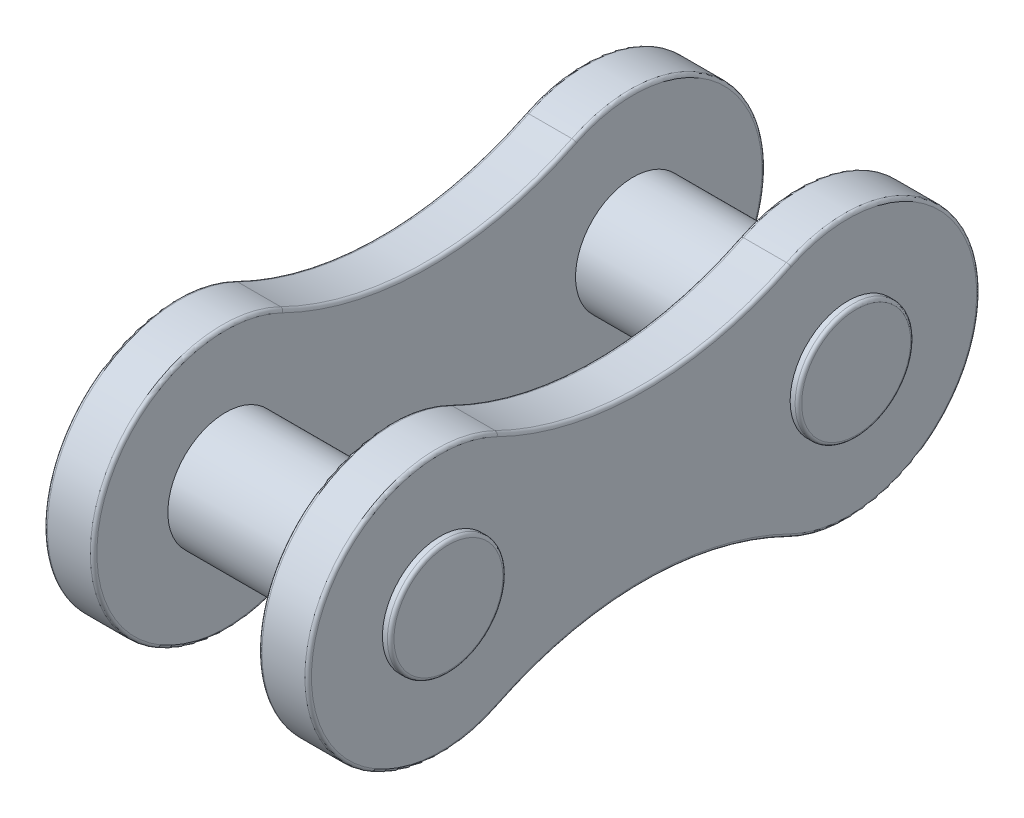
SolidWorks part; units mm, degrees
ref_plane "Front Plane" through (0, 0, 0) normal (0, 0, 1) x (1, 0, 0)
ref_plane "Top Plane" through (0, 0, 0) normal (0, 1, 0) x (1, 0, 0)
ref_plane "Right Plane" through (0, 0, 0) normal (1, 0, 0) x (0, 0, -1)
sketch "Sketch1" plane through (0, 0, 0) normal (1, 0, 0) x (0, 0, -1)
  line L0 (-6.175, 0) -> (6.175, 0) construction
  line L1 (0, 0) -> (0, 5.1759) construction
  circle A0 centre (-6.175, 0) radius 1.75
  arc A1 (-4.4107, 3.5899) -> (-4.4107, -3.5899) centre (-6.175, 0) ccw
  circle A2 centre (6.175, 0) radius 1.75
  arc A3 (4.4107, 3.5899) -> (4.4107, -3.5899) centre (6.175, 0) cw
  arc A4 (-4.4107, 3.5899) -> (4.4107, 3.5899) centre (0, 12.5646) ccw
  arc A5 (-4.4107, -3.5899) -> (4.4107, -3.5899) centre (0, -12.5646) cw
  dimension "D2" = 3.5
  dimension "D3" = 8
  dimension "D4" = 10
  dimension "D1" = 12.35
extrude "Boss-Extrude1" add sketch "Sketch1" along normal blind 1.5 from offset 2.5
sketch "Sketch2" plane through (0, 0, 0) normal (1, 0, 0) x (0, 0, -1)
  arc A0 (4.4107, -3.5899) -> (-4.4107, -3.5899) centre (0, -12.5646) ccw construction
  circle A1 centre (6.175, 0) radius 1.75 construction
  arc A2 (4.4107, -3.5899) -> (4.4107, 3.5899) centre (6.175, 0) ccw construction
  circle A3 centre (-6.175, 0) radius 1.75 construction
  arc A4 (-4.4107, 3.5899) -> (-4.4107, -3.5899) centre (-6.175, 0) ccw construction
  arc A5 (-4.4107, 3.5899) -> (4.4107, 3.5899) centre (0, 12.5646) ccw construction
  arc A6 (4.4107, -3.5899) -> (-4.4107, -3.5899) centre (0, -12.5646) ccw
  circle A7 centre (6.175, 0) radius 1.75
  arc A8 (4.4107, -3.5899) -> (4.4107, 3.5899) centre (6.175, 0) ccw
  circle A9 centre (-6.175, 0) radius 1.75
  arc A10 (-4.4107, 3.5899) -> (-4.4107, -3.5899) centre (-6.175, 0) ccw
  arc A11 (-4.4107, 3.5899) -> (4.4107, 3.5899) centre (0, 12.5646) ccw
extrude "Boss-Extrude2" add sketch "Sketch2" against normal blind 1.5 from offset 2.5 separate body
sketch "Sketch3" plane through (0, 0, 0) normal (1, 0, 0) x (0, 0, -1)
  circle A0 centre (6.175, 0) radius 1.75 construction
  circle A1 centre (-6.175, 0) radius 1.75 construction
  circle A2 centre (6.175, 0) radius 1.75
  circle A3 centre (-6.175, 0) radius 1.75
extrude "Boss-Extrude3" add sketch "Sketch3" along normal mid plane 8.5
fillet "Fillet1" radius 0.1 19 edges at (-4, 2.5646, 0) (-4, 0, -10.175) (-4, -2.5646, 0) (-2.5, 2.5646, 0) (-2.5, 0, -10.175) (-2.5, -2.5646, 0) (2.5, 2.5646, 0) (2.5, 0, -10.175) (2.5, -2.5646, 0) (4, 2.5646, 0) (4, 0, -10.175) (4, -2.5646, 0) (-4.25, 0, 4.425) (-4, 0, 10.175) (-2.5, 0, 10.175) (2.5, 0, 10.175) (4.25, 0, 4.425) (4.25, 0, -7.925) (4, 0, 10.175)
